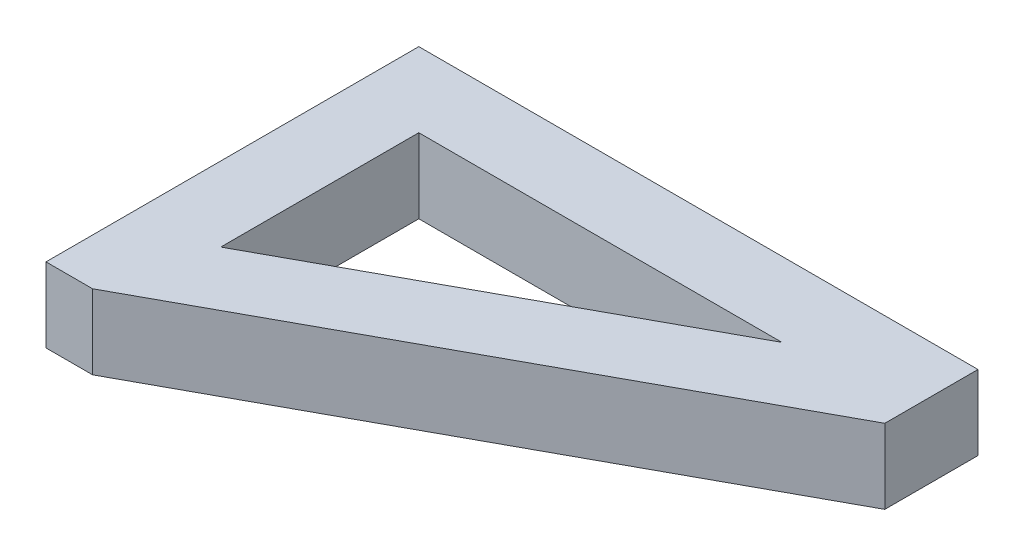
SolidWorks part; units mm, degrees
ref_plane "Alzado" through (0, 0, 0) normal (0, 0, 1) x (1, 0, 0)
ref_plane "Planta" through (0, 0, 0) normal (0, 1, 0) x (1, 0, 0)
ref_plane "Vista lateral" through (0, 0, 0) normal (1, 0, 0) x (0, 0, -1)
sketch "Croquis1" plane through (0, 0, 0) normal (0, 1, 0) x (1, 0, 0)
  line L0 (0, 0) -> (0, 100)
  line L1 (0, 100) -> (150, 100)
  line L2 (150, 100) -> (150, 75)
  line L3 (150, 75) -> (12.5, 0)
  line L4 (12.5, 0) -> (0, 0)
  line L5 (20, 80) -> (117.4001, 80)
  line L6 (117.4001, 80) -> (117.4001, 80)
  line L7 (117.4001, 80) -> (20, 26.8727)
  line L8 (20, 26.8727) -> (20, 26.8727)
  line L9 (20, 26.8727) -> (20, 80)
  dimension "D1" = 150
  dimension "D2" = 100
  dimension "D3" = 12.5
  dimension "D4" = 25
  dimension "D5" = 20
extrude "Saliente-Extruir1" add sketch "Croquis1" along normal blind 20
